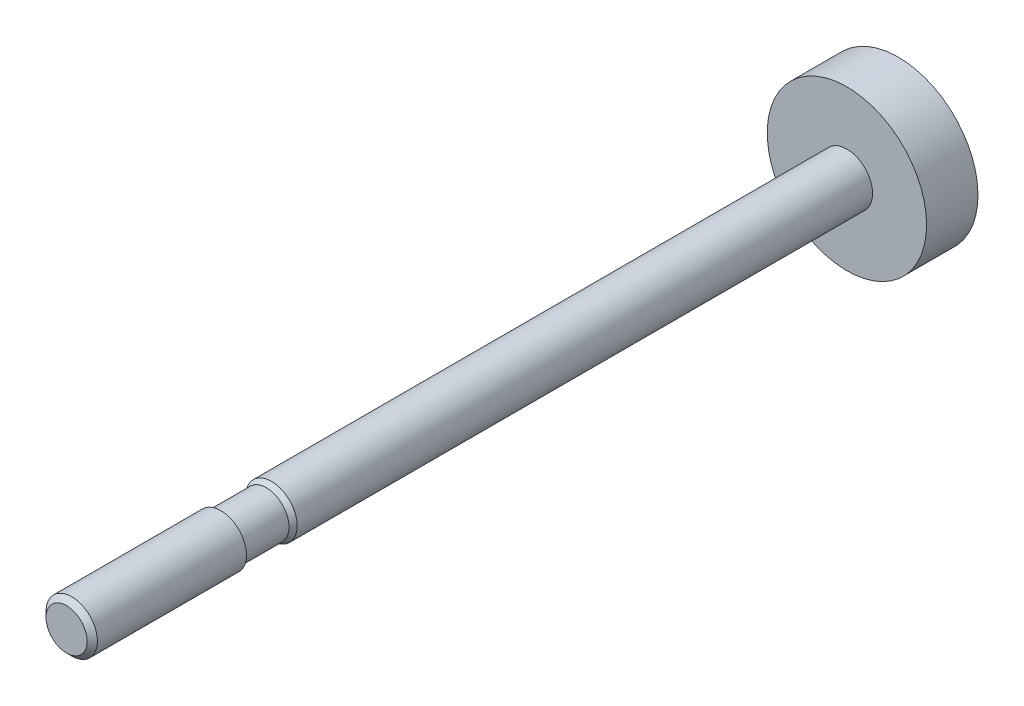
SolidWorks part; units mm, degrees
ref_plane "Plane1" through (0, 0, 0) normal (0, 0, 1) x (1, 0, 0)
ref_plane "Plane2" through (0, 0, 0) normal (0, 1, 0) x (1, 0, 0)
ref_plane "Plane3" through (0, 0, 0) normal (1, 0, 0) x (0, 0, -1)
sketch "Sketch1" plane through (0, 0, 0) normal (0, 0, 1) x (1, 0, 0)
  circle A0 centre (0, 0) radius 7.75
  dimension "D1" = 15.5
extrude "Piston" add sketch "Sketch1" along normal mid plane 5
ref_plane "ExtrusionBase" through (0, 0, 0) normal (0, 0, -1) x (-1, 0, 0)
sketch "Sketch2" plane through (0, 0, 0) normal (0, 0, 1) x (1, 0, 0)
  circle A0 centre (0, 0) radius 2.5
  dimension "D1" = 5
extrude "Rod" add sketch "Sketch2" along normal blind 58.97
chamfer "Chamfer1" distance 0.5 angle 30
sketch "Sketch3" plane through (0, 0, 58.97) normal (0, 0, 1) x (1, 0, 0)
  circle A1 centre (0, 0) radius 2.2113
  circle A2 centre (0, 0) radius 2.2113
  dimension "D1" = 0
extrude "Shaft" add sketch "Sketch3" along normal blind 4.43
sketch "Sketch4" plane through (0, 0, 63.4) normal (0, 0, 1) x (1, 0, 0)
  circle A0 centre (0, 0) radius 2.5
  dimension "D1" = 5
extrude "ExternalThread" add sketch "Sketch4" along normal blind 15
chamfer "Chamfer2" distance 0.5 angle 45
